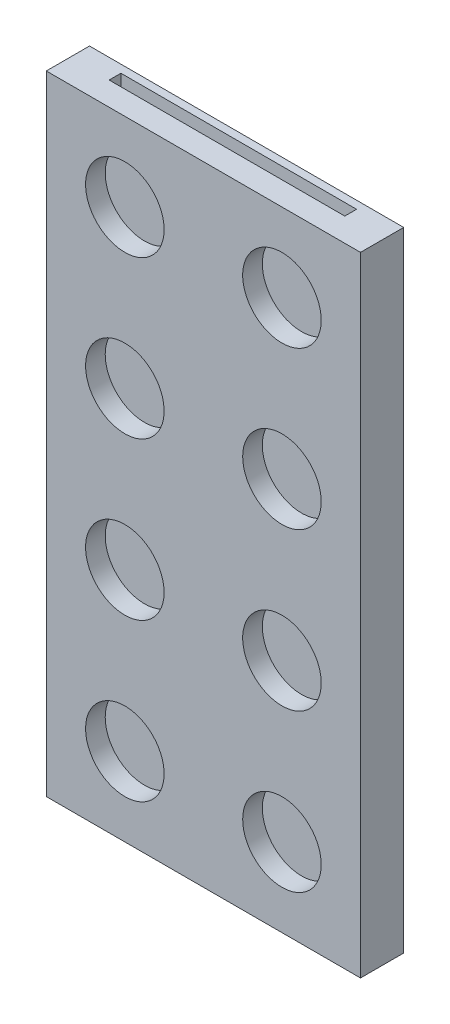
SolidWorks part; units mm, degrees
ref_plane "Front Plane" through (0, 0, 0) normal (0, 0, 1) x (1, 0, 0)
ref_plane "Top Plane" through (0, 0, 0) normal (0, 1, 0) x (1, 0, 0)
ref_plane "Right Plane" through (0, 0, 0) normal (1, 0, 0) x (0, 0, -1)
sketch "Sketch1" plane through (0, 0, 0) normal (0, 0, 1) x (1, 0, 0)
  line L1 (0, 0) -> (50.8, 0)
  line L2 (0, 0) -> (0, 101.6)
  line L3 (0, 101.6) -> (50.8, 101.6)
  line L4 (50.8, 0) -> (50.8, 101.6)
  dimension "D1" = 101.6
  dimension "D2" = 50.8
extrude "Boss-Extrude1" add sketch "Sketch1" along normal blind 6.985
sketch "Sketch3" plane through (0, 0, 6.985) normal (0, 0, 1) x (1, 0, 0)
  line L0 (0, 101.6) -> (0, 0) construction
  line L1 (50.8, 101.6) -> (0, 101.6) construction
  line L2 (0, 0) -> (50.8, 0) construction
  line L3 (25.4, 101.6) -> (25.4, 0)
  line L5 (12.7, 152.4) -> (12.7, 0)
  line L6 (38.1, 101.6) -> (38.1, 0)
  line L7 (50.8, 101.6) -> (50.8, 0)
  line L8 (63.5, 101.6) -> (63.5, 0)
  line L9 (76.2, 101.6) -> (76.2, 0)
  line L10 (88.9, 101.6) -> (88.9, 0)
  line L11 (0, 12.7) -> (50.8, 12.7)
  line L12 (50.8, 0) -> (50.8, 101.6) construction
  line L13 (0, 25.4) -> (50.8, 25.4)
  line L14 (0, 38.1) -> (50.8, 38.1)
  line L15 (0, 50.8) -> (50.8, 50.8)
  line L16 (0, 63.5) -> (50.8, 63.5)
  line L17 (0, 63.6141) -> (50.8, 63.6141)
  line L18 (0, 76.2) -> (50.8, 76.2)
  line L19 (0, 88.9) -> (50.8, 88.9)
  line L20 (0, 101.6) -> (50.8, 101.6)
  line L21 (0, 114.3) -> (50.8, 114.3)
  line L22 (0, 127) -> (50.8, 127)
  line L23 (0, 139.7) -> (50.8, 139.7)
  circle A0 centre (12.7, 139.7) radius 6.35
  circle A2 centre (38.1, 139.7) radius 6.35
  circle A4 centre (63.5, 139.7) radius 2.54
  circle A6 centre (88.9, 139.7) radius 2.54
  circle A7 centre (88.9, 114.3) radius 2.54
  circle A8 centre (63.5, 114.3) radius 2.54
  circle A9 centre (38.1, 114.3) radius 6.35
  circle A10 centre (12.7, 114.3) radius 6.35
  circle A11 centre (88.9, 88.9) radius 2.54
  circle A12 centre (63.5, 88.9) radius 2.54
  circle A13 centre (38.1, 88.9) radius 6.35
  circle A14 centre (12.7, 88.9) radius 6.35
  circle A15 centre (88.9, 63.5) radius 2.54
  circle A16 centre (63.5, 63.5) radius 2.54
  circle A17 centre (38.1, 63.5) radius 6.35
  circle A18 centre (12.7, 63.5) radius 6.35
  circle A19 centre (88.9, 38.1) radius 2.54
  circle A20 centre (63.5, 38.1) radius 2.54
  circle A21 centre (38.1, 38.1) radius 6.35
  circle A22 centre (12.7, 38.1) radius 6.35
  circle A23 centre (88.9, 12.7) radius 2.54
  circle A24 centre (63.5, 12.7) radius 2.54
  circle A25 centre (38.1, 12.7) radius 6.35
  circle A26 centre (12.7, 12.7) radius 6.35
  dimension "D1" = 12.7
  dimension "D2" = 12.7
  dimension "D3" = 12.7
  dimension "D4" = 12.7
  dimension "D5" = 12.7
  dimension "D6" = 12.7
  dimension "D7" = 12.7
  dimension "D8" = 12.7
  dimension "D9" = 12.7
  dimension "D10" = 12.7
  dimension "D11" = 12.7
  dimension "D12" = 12.7
  dimension "D13" = 12.7
  dimension "D14" = 12.7
  dimension "D15" = 12.7
  dimension "D16" = 12.7
  dimension "D17" = 12.7
  dimension "D18" = 12.7
extrude "Cut-Extrude2" cut sketch "Sketch3" against normal blind 3.175 contours A0 | A2 | A4 | A6 | A7 | A8 | A9 | A10 | A14 | A13 | A12 | A11 | A18 | A17 | A16 | A15 | A22 | A21 | A20 | A19 | A26 | A25 | A24 | A23
sketch "Sketch4" plane through (0, 0, 0) normal (0, 0, -1) x (-1, 0, 0)
  line L0 (-43.18, 93.98) -> (-7.62, 93.98)
  line L1 (-7.62, 93.98) -> (-7.62, 7.62)
  line L2 (-7.62, 7.62) -> (-43.18, 7.62)
  line L3 (-43.18, 7.62) -> (-43.18, 93.98)
  line L4 (-50.8, 0) -> (-50.8, 101.6) construction
  line L5 (0, 101.6) -> (0, 0) construction
  line L6 (-50.8, 101.6) -> (0, 101.6) construction
  line L7 (0, 0) -> (-50.8, 0) construction
  dimension "D1" = 7.62
  dimension "D2" = 7.62
  dimension "D3" = 7.62
  dimension "D4" = 7.62
sketch "Sketch5" plane through (0, 101.6, 0) normal (0, 1, 0) x (1, 0, 0)
  line L0 (6.35, -1.27) -> (44.45, -1.27)
  line L1 (44.45, -1.27) -> (44.45, -3.175)
  line L2 (44.45, -3.175) -> (6.35, -3.175)
  line L3 (6.35, -3.175) -> (6.35, -1.27)
  line L4 (0, -6.985) -> (0, 0) construction
  line L5 (50.8, -6.985) -> (50.8, 0) construction
  line L6 (50.8, 0) -> (0, 0) construction
  dimension "D1" = 6.35
  dimension "D2" = 6.35
  dimension "D3" = 1.27
  dimension "D4" = 1.905
extrude "Cut-Extrude3" cut sketch "Sketch4" against normal blind 2.54
extrude "Cut-Extrude4" cut sketch "Sketch5" against normal blind 95.25
